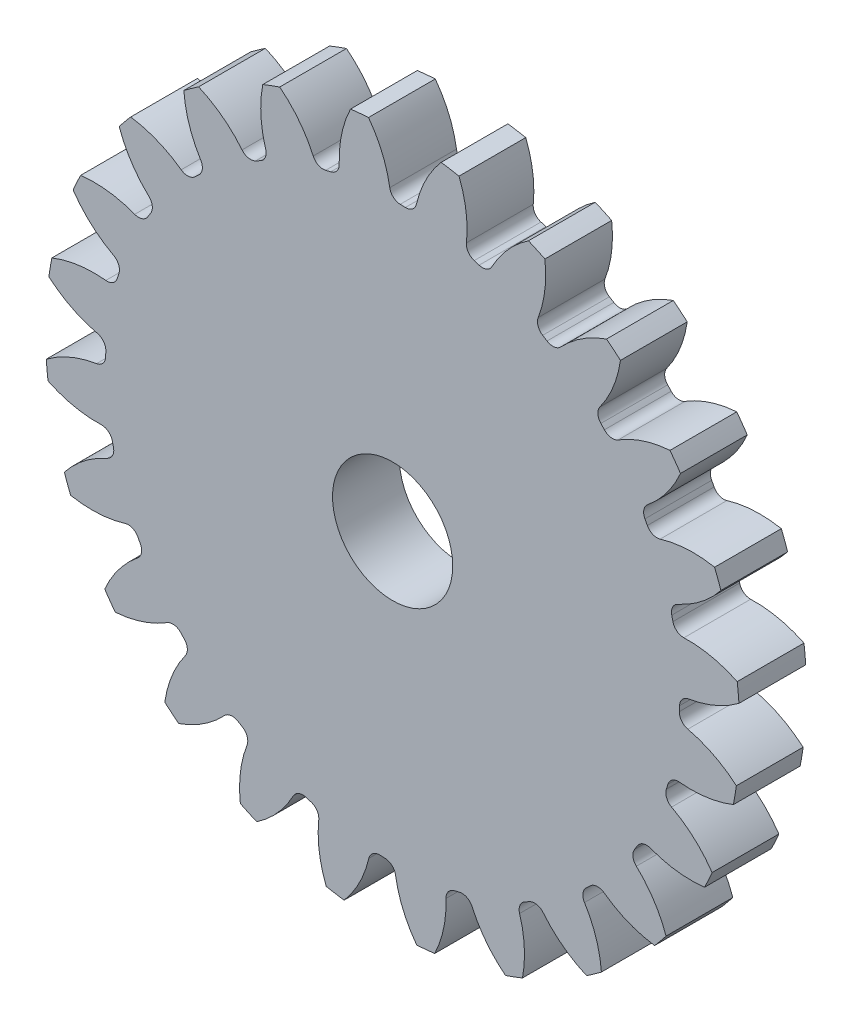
SolidWorks part; units mm, degrees
ref_plane "Front" through (0, 0, 0) normal (0, 0, 1) x (1, 0, 0)
ref_plane "Top" through (0, 0, 0) normal (0, 1, 0) x (1, 0, 0)
ref_plane "Right" through (0, 0, 0) normal (1, 0, 0) x (0, 0, -1)
sketch "Sketch3" plane through (0, 0, 0) normal (0, 0, 1) x (1, 0, 0)
  circle A0 centre (0, 0) radius 660.4
  dimension "od" = 1320.8
extrude "gearBody" add sketch "Sketch3" along normal blind 127
sketch "Sketch2" plane through (0, 0, 0) normal (0, 0, 1) x (1, 0, 0)
  line L0 (0, 0) -> (529.232, 219.2151) construction
  line L1 (655.4246, -93.5927) -> (0, 0) construction
  line L2 (0, 0) -> (36.3143, 0) construction
  line L3 (609.3302, 18.1349) -> (606.5252, -61.1499) construction
  line L5 (607.9277, -21.5075) -> (0, 0) construction
  line L7 (0, 0) -> (572.8366, 0) construction
  arc A0 (572.7914, 7.1973) -> (570.8507, -47.6575) centre (0, 0) ccw construction
  arc A1 (658.8072, 45.8391) -> (653.9207, -92.2812) centre (0, 0) ccw construction
  arc A2 (609.3302, 18.1349) -> (606.5252, -61.1499) centre (0, 0) ccw construction
  arc A3 (545.563, -24.2125) -> (545.9101, -14.402) centre (0, 0) ccw
  arc A4 (655.4246, -93.5927) -> (561.5271, -45.2656) centre (512.4173, -256.067) ccw
  arc A5 (655.4246, -93.5927) -> (660.4, 47.0409) centre (0, 0) ccw
  arc A6 (660.4, 47.0409) -> (563.3221, 5.4703) centre (529.232, 219.2151) cw
  arc A7 (545.9101, -14.402) -> (563.3221, 5.4703) centre (566.5785, -14.9473) cw
  arc A8 (561.5271, -45.2656) -> (545.563, -24.2125) centre (566.2182, -25.1292) cw
  point P6 (660.4, 47.0409)
  point P22 (655.4246, -93.5927)
  dimension "baseDia" = 1145.6732
  dimension "od" = 1320.8
  dimension "pd" = 1219.2
  dimension "rd" = 1092.2
  dimension "rFillet" = 20.6756
  dimension "pointX" = 660.4
  dimension "pointY" = 47.0409
  dimension "CTT" = 79.2847
  dimension "flankCenterAngle" = 22.5
extrude "toothCut" cut sketch "Sketch2" along normal through all
pattern_circular "CirPattern1" count 24 over 360 about axis through (0, 0, 0) along (0, 0, 1) of "toothCut"
sketch "hub1Dia" plane through (0, 0, 0) normal (0, 0, -1) x (-1, 0, 0)
  circle A0 centre (0, 0) radius 12.7
  dimension "hub1Dia" = 25.4
sketch "hub2Dia" plane through (0, 0, 127) normal (0, 0, 1) x (1, 0, 0)
  circle A0 centre (0, 0) radius 12.7
  dimension "hub2dia" = 25.4
sketch "boreDia" plane through (0, 0, 0) normal (0, 0, 1) x (1, 0, 0)
  circle A0 centre (0, 0) radius 114.3
  dimension "boreDia" = 228.6
extrude "bore" cut sketch "boreDia" against normal mid plane 25400
